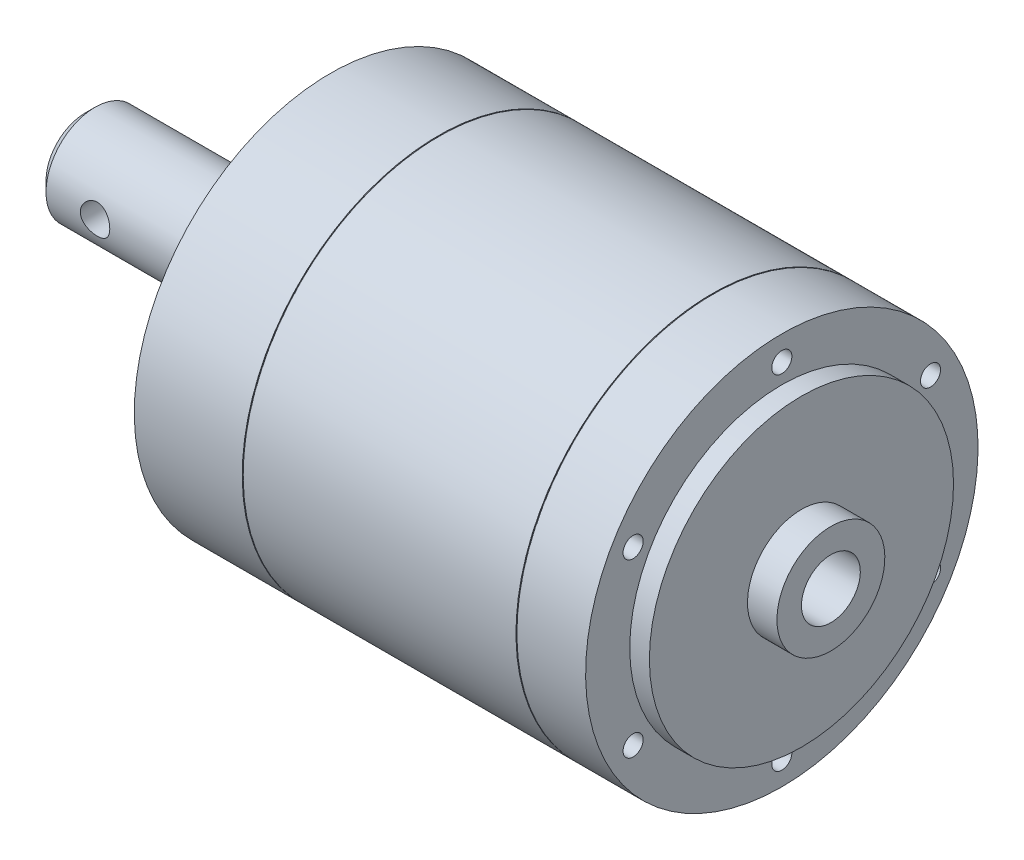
SolidWorks part; units mm, degrees
ref_plane "Plan1" through (0, 0, 0) normal (0, 0, 1) x (1, 0, 0)
ref_plane "Plan2" through (0, 0, 0) normal (0, 1, 0) x (1, 0, 0)
ref_plane "Plan3" through (0, 0, 0) normal (1, 0, 0) x (0, 0, -1)
sketch "Esquisse1" plane through (0, 0, 0) normal (0, 0, 1) x (1, 0, 0)
  line L0 (-54, 0) -> (-54, 12)
  line L1 (-54, 12) -> (-51, 12)
  line L2 (-51, 12) -> (-51, 20)
  line L3 (-51, 20) -> (-40, 20)
  line L4 (-40, 20) -> (-40, 19.9)
  line L5 (-40, 19.9) -> (-39.9, 19.9)
  line L6 (-39.9, 19.9) -> (-39.9, 20)
  line L7 (-39.9, 20) -> (-12.1, 20)
  line L8 (-12.1, 20) -> (-12.1, 19.9)
  line L9 (-12.1, 19.9) -> (-12, 19.9)
  line L10 (-12, 19.9) -> (-12, 20)
  line L11 (-12, 20) -> (-5, 20)
  line L12 (-5, 20) -> (-5, 15.5)
  line L13 (-92, 0) -> (31.2, 0) construction
  line L14 (-5, 15.5) -> (-3, 15.5)
  line L15 (-3, 15.5) -> (-3, 5.5)
  line L16 (-3, 5.5) -> (0, 5.5)
  line L17 (0, 5.5) -> (0, 0)
  line L20 (-54, 0) -> (0, 0)
  dimension "D1" = 3
  dimension "D2" = 12
  dimension "D3" = 20
  dimension "D4" = 0.1
  dimension "D5" = 0.1
  dimension "D6" = 0.1
  dimension "D7" = 0.1
  dimension "D8" = 20
  dimension "D9" = 20
  dimension "D10" = 7
  dimension "D11" = 11
  dimension "D12" = 2
  dimension "D13" = 15.5
  dimension "D14" = 3
  dimension "D15" = 5.5
  dimension "D16" = 51
revolve "Base-Révolution" add sketch "Esquisse1" angle 360 about L13
shell "Coque2" thickness 5
chamfer "Chanfrein1" distance 0.5 angle 45 1 edges at (-54, -12, 0)
sketch "Esquisse5" plane through (0, 0, 0) normal (1, 0, 0) x (0, 0, -1)
  circle A0 centre (0, 0) radius 3
  dimension "D1" = 6
extrude "Enlèv. mat.-Extru.1" cut sketch "Esquisse5" against normal up to next
hole_wizard "Trou taraudé M41" positions "Esquisse3" profile "Esquisse4" tap size "M4" standard "ISO"
sketch "Esquisse3" plane through (-51, 0, 0) normal (-1, 0, 0) x (0, 0, 1)
  point P0 (0, 17.5)
  dimension "D1" = 17.5
sketch "Esquisse4" plane through (-51, 17.5, 0) normal (0, 1, 0) x (0, 0, 1)
  line L0 (0, 0) -> (0, 12.4526)
  line L1 (0, 12.4526) -> (1.65, 11.5)
  line L2 (1.65, 11.5) -> (1.65, 0)
  line L5 (1.65, 0) -> (0, 0)
  line L10 (0, 12.4526) -> (-1.65, 11.5) construction
  line L11 (0, -6.35) -> (0, 107.95) construction
  dimension "Diamètre du trou pour taraudage" = 3.3
  dimension "Profondeur du trou pour taraudage" = 11.5
  dimension "Angle de pointe" = 120
hole_wizard "Trou taraudé M2.51" positions "Esquisse7" profile "Esquisse6" tap size "M2.5" standard "ISO"
sketch "Esquisse7" plane through (-5, 0, 0) normal (1, 0, 0) x (0, 0, -1)
  point P0 (0, 17.5)
  dimension "D1" = 17.5
sketch "Esquisse6" plane through (-5, 17.5, 0) normal (0, 1, 0) x (0, 0, -1)
  line L0 (0, 0) -> (0, 20.5918)
  line L1 (0, 20.5918) -> (1.025, 20)
  line L2 (1.025, 20) -> (1.025, 0)
  line L5 (1.025, 0) -> (0, 0)
  line L10 (0, 20.5918) -> (-1.025, 20) construction
  line L11 (0, -6.35) -> (0, 107.95) construction
  dimension "Diamètre du trou pour taraudage" = 2.05
  dimension "Profondeur du trou pour taraudage" = 20
  dimension "Angle de pointe" = 120
pattern_circular "Répétition circulaire1" count 8 every 45 about axis through (0, 0, 0) along (1, 0, 0) of "Trou taraudé M41"
pattern_circular "Répétition circulaire2" count 6 every 60 about axis through (0, 0, 0) along (1, 0, 0) of "Trou taraudé M2.51"
sketch "Esquisse8" plane through (-54, 0, 0) normal (-1, 0, 0) x (0, 0, 1)
  circle A0 centre (0, 0) radius 5
  dimension "D1" = 10
extrude "Extrusion1" add sketch "Esquisse8" along normal blind 22
chamfer "Chanfrein2" distance 1 angle 45 1 edges at (-76, -5, 0)
sketch "Esquisse9" plane through (0, 0, 0) normal (0, 0, 1) x (1, 0, 0)
  line L0 (-54, 11.5) -> (-54, -11.5) construction
  circle A0 centre (-70, 0) radius 1.5
  dimension "D1" = 3
  dimension "D2" = 16
extrude "Enlèv. mat.-Extru.2" cut sketch "Esquisse9" against normal through all and the other way through all
